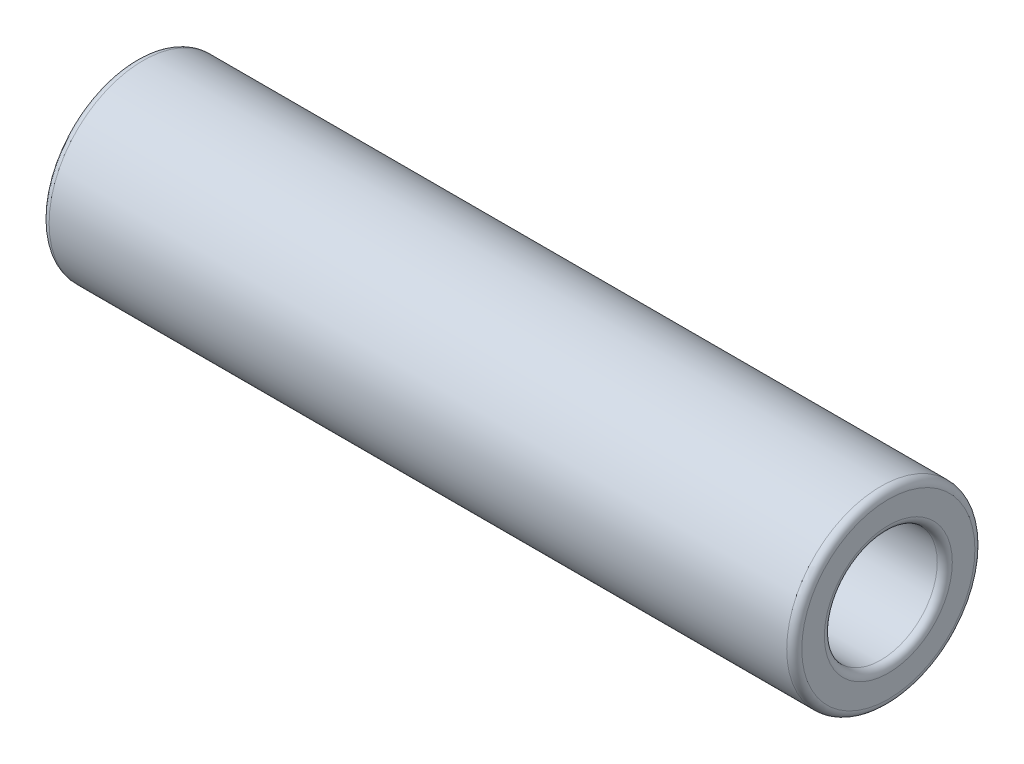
SolidWorks part; units mm, degrees
ref_plane "Front Plane" through (0, 0, 0) normal (0, 0, 1) x (1, 0, 0)
ref_plane "Top Plane" through (0, 0, 0) normal (0, 1, 0) x (1, 0, 0)
ref_plane "Right Plane" through (0, 0, 0) normal (1, 0, 0) x (0, 0, -1)
sketch "Sketch1" plane through (0, 0, 0) normal (1, 0, 0) x (0, 0, -1)
  circle A0 centre (0, 0) radius 3.75
  circle A1 centre (0, 0) radius 6.25
  dimension "D1" = 7.5
  dimension "D2" = 12.5
extrude "Boss-Extrude1" add sketch "Sketch1" along normal blind 50
fillet "Fillet1" radius 0.5 4 edges at (0, 0, -3.75) (0, 0, -6.25) (50, 0, -3.75) (50, 0, -6.25)
